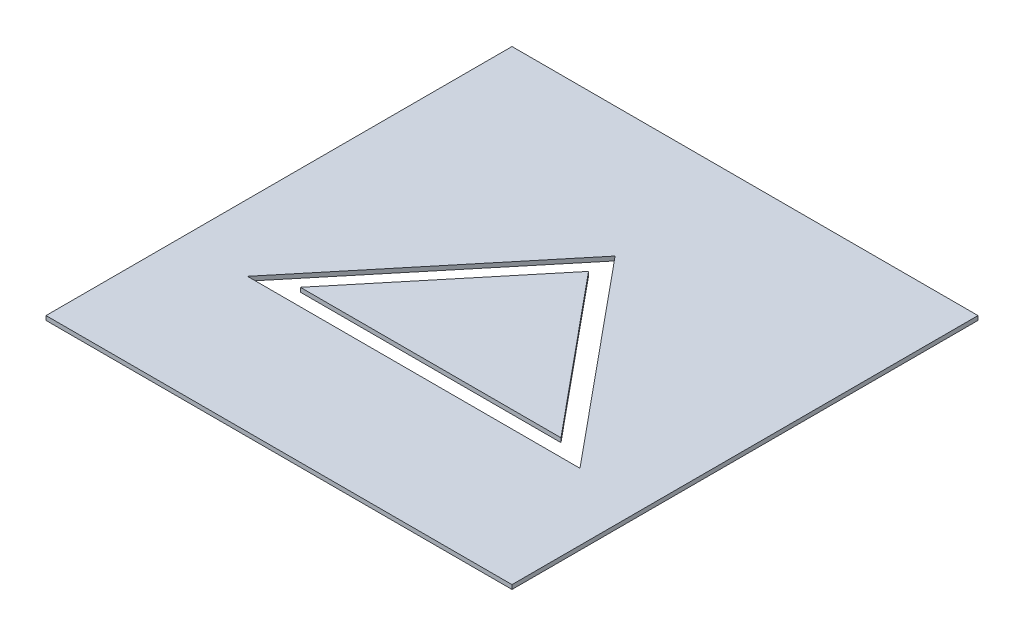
SolidWorks part; units mm, degrees
ref_plane "Front Plane" through (0, 0, 0) normal (0, 0, 1) x (1, 0, 0)
ref_plane "Top Plane" through (0, 0, 0) normal (0, 1, 0) x (1, 0, 0)
ref_plane "Right Plane" through (0, 0, 0) normal (1, 0, 0) x (0, 0, -1)
sketch "Sketch1" plane through (0, 0, 0) normal (0, 1, 0) x (1, 0, 0)
  line L0 (-139.7, 279.4) -> (-139.7, 0) construction
  line L1 (0, 0) -> (-279.4, 0)
  line L2 (0, 0) -> (0, 279.4)
  line L3 (0, 279.4) -> (-279.4, 279.4)
  line L4 (-279.4, 0) -> (-279.4, 279.4)
  line L5 (-279.4, 139.7) -> (0, 139.7) construction
  line L6 (-279.4, 193.548) -> (0, 193.548) construction
  line L7 (-279.4, 85.852) -> (0, 85.852) construction
  line L8 (-228.6, 279.4) -> (-228.6, 0) construction
  line L9 (-50.8, 0) -> (-50.8, 279.4) construction
  line L10 (-139.7, 193.5431) -> (-228.6, 85.852)
  line L11 (-228.6, 85.852) -> (-50.8, 85.852)
  line L12 (-50.8, 85.852) -> (-139.7, 193.5431)
  line L13 (-139.7, 185.5634) -> (-217.8191, 90.932)
  line L14 (-217.8191, 90.932) -> (-61.5809, 90.932)
  line L15 (-61.5809, 90.932) -> (-139.7, 185.5634)
  line L17 (-139.7, 201.5227) -> (-40.0191, 80.772)
  line L18 (-40.0191, 80.772) -> (-239.3809, 80.772)
  line L19 (-239.3809, 80.772) -> (-139.7, 201.5227)
  point P17 (-228.6, 85.852)
  point P18 (-50.8, 85.852)
  point P19 (-50.8, 193.548)
  point P20 (-228.6, 193.548)
  dimension "D1" = 279.4
  dimension "D2" = 279.4
  dimension "D3" = 85.852
  dimension "D4" = 85.852
  dimension "D5" = 50.8
  dimension "D6" = 50.8
  dimension "D7" = 5.08
  dimension "D8" = 5.08
  dimension "D9" = 50.46
  dimension "D10" = 50.46
  dimension "D11" = 5.08
  dimension "D12" = 5.08
  dimension "D13" = 5.08
  dimension "D14" = 50.46
extrude "Boss-Extrude1" add sketch "Sketch1" along normal blind 2.54 contours L4 L1 L2 L3 L18 L19 L17 | L14 L15 L13
